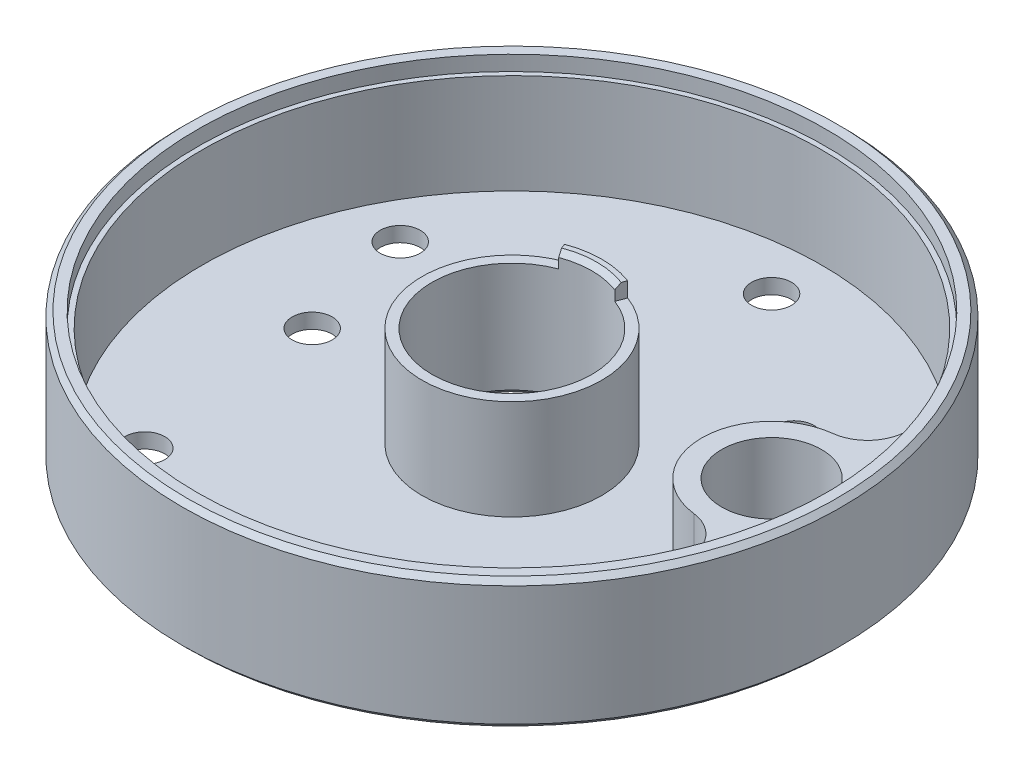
SolidWorks part; units mm, degrees
ref_plane "Front Plane" through (0, 0, 0) normal (0, 0, 1) x (1, 0, 0)
ref_plane "Top Plane" through (0, 0, 0) normal (0, 1, 0) x (1, 0, 0)
ref_plane "Right Plane" through (0, 0, 0) normal (1, 0, 0) x (0, 0, -1)
sketch "Sketch1" plane through (0, 0, 0) normal (0, 1, 0) x (1, 0, 0)
  circle A0 centre (0, 0) radius 8
  circle A1 centre (0, 0) radius 20 construction
  circle A2 centre (0, 0) radius 33
  circle A3 centre (0, 0) radius 14 construction
  circle A4 centre (0, 0) radius 26 construction
extrude "Boss-Extrude1" add sketch "Sketch1" against normal blind 13
sketch "Sketch2" plane through (0, 0, 0) normal (0, 1, 0) x (1, 0, 0)
  line L0 (0, 0) -> (0, 8) construction
  line L1 (0, 8) -> (3, 8) construction
  line L2 (2.809, 7.4906) -> (3, 8)
  line L3 (3, 8) -> (3.1601, 8.427)
  line L4 (-3, 8) -> (-3.1601, 8.427)
  line L5 (-2.809, 7.4906) -> (-3, 8)
  arc A0 (-2.809, 7.4906) -> (2.809, 7.4906) centre (0, 0) ccw
  circle A1 centre (0, 0) radius 31.5
  arc A2 (3.1601, 8.427) -> (-3.1601, 8.427) centre (0, 0) ccw
extrude "Cut-Extrude1" cut sketch "Sketch2" against normal blind 1.5
sketch "Sketch3" plane through (0, -1.5, 0) normal (0, 1, 0) x (1, 0, 0)
  circle A0 centre (26, 0) radius 5
  circle A1 centre (0, 0) radius 26 construction
extrude "Cut-Extrude2" cut sketch "Sketch3" against normal through all
sketch "Sketch4" plane through (0, -1.5, 0) normal (0, 1, 0) x (1, 0, 0)
  line L0 (20, 0) -> (20, 23.6854) construction
  line L1 (20, 0) -> (31, 0) construction
  circle A0 centre (0, 0) radius 9
  arc A1 (28.3504, 12.5401) -> (28.3504, -12.5401) centre (0, 0) ccw
  circle A2 centre (0, 0) radius 20 construction
  arc A3 (25.1678, 6.9504) -> (25.1678, -6.9504) centre (26, 0) ccw
  arc A4 (25.1678, -6.9504) -> (28.3504, -12.5401) centre (24.6923, -10.922) cw
  arc A5 (25.1678, 6.9504) -> (28.3504, 12.5401) centre (24.6923, 10.922) ccw
  dimension "D1" = 4
extrude "Cut-Extrude3" cut sketch "Sketch4" against normal blind 10
sketch "Sketch5" plane through (0, -11.5, 0) normal (0, 1, 0) x (1, 0, 0)
  circle A0 centre (0, 26) radius 2
  circle A1 centre (0, 0) radius 26 construction
  circle A2 centre (-20, 0) radius 2
  circle A3 centre (0, 0) radius 20 construction
  circle A4 centre (5.5622, -19.211) radius 2
  circle A5 centre (-18, -18.7617) radius 2
  circle A6 centre (18, -18.7617) radius 2
  circle A7 centre (13.5513, 14.7092) radius 2
  circle A8 centre (-9.8782, 9.9208) radius 5
  circle A9 centre (0, 0) radius 14 construction
  circle A10 centre (-23.1062, 11.9208) radius 2
extrude "Cut-Extrude4" cut sketch "Sketch5" against normal through all
chamfer "Chamfer1" distance 0.5 angle 45 3 edges at (0, -13, 33) (0, 0, 33) (0, 0, -8)
chamfer "Chamfer2" distance 0.5 angle 45 1 edges at (0, -13, 8)
